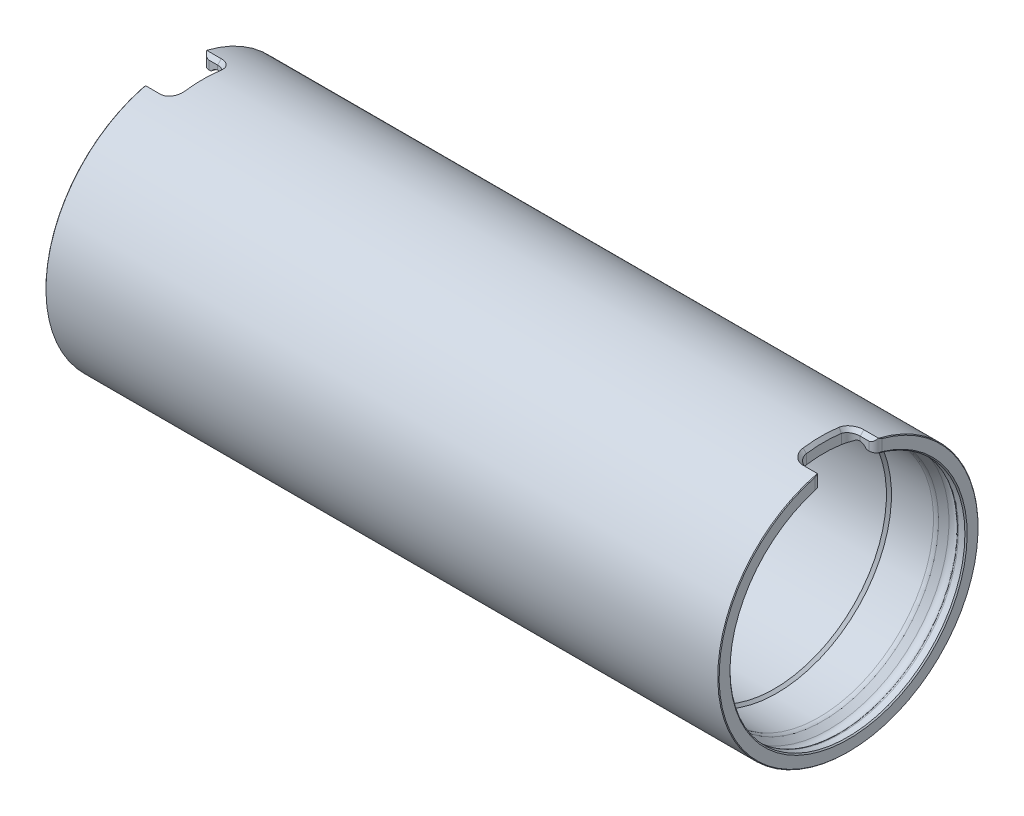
SolidWorks part; units mm, degrees
other "<WTE2-LOCKING-TUBE-R1>-<Chamfer1>"
ref_plane "Front Plane" through (0, 0, 0) normal (0, 0, 1) x (1, 0, 0)
ref_plane "Top Plane" through (0, 0, 0) normal (0, 1, 0) x (1, 0, 0)
ref_plane "Right Plane" through (0, 0, 0) normal (1, 0, 0) x (0, 0, -1)
inserted part "WTE2-LOCKING-TUBE-R1"
